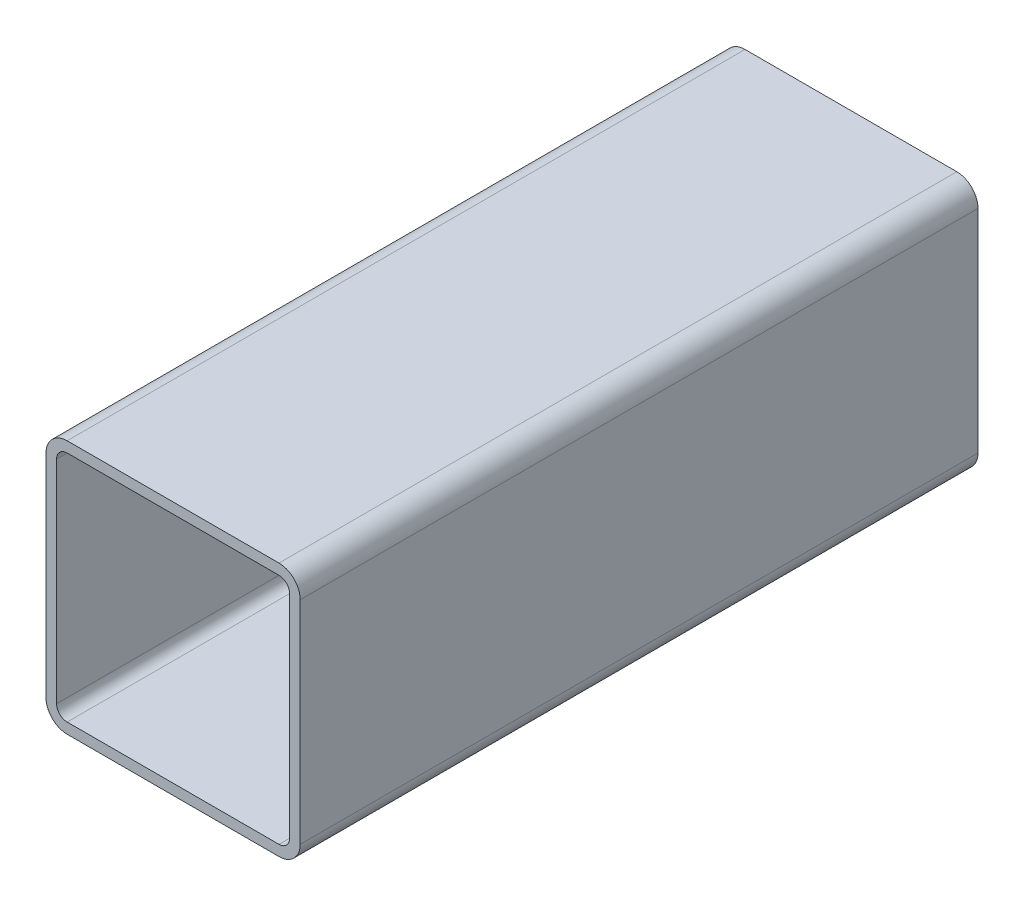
SolidWorks part; units mm, degrees
ref_plane "Front Plane" through (0, 0, 0) normal (0, 0, 1) x (1, 0, 0)
ref_plane "Top Plane" through (0, 0, 0) normal (0, 1, 0) x (1, 0, 0)
ref_plane "Right Plane" through (0, 0, 0) normal (1, 0, 0) x (0, 0, -1)
sketch "Sketch1" plane through (0, 0, 0) normal (0, 0, 1) x (1, 0, 0)
sketch_block_instance "HSS4.5x4.5x0.1875-1"
sketch_block "HSS4.5x4.5x0.1875"
extrude "Boss-Extrude1" add sketch "Sketch1" along normal blind 304.8
